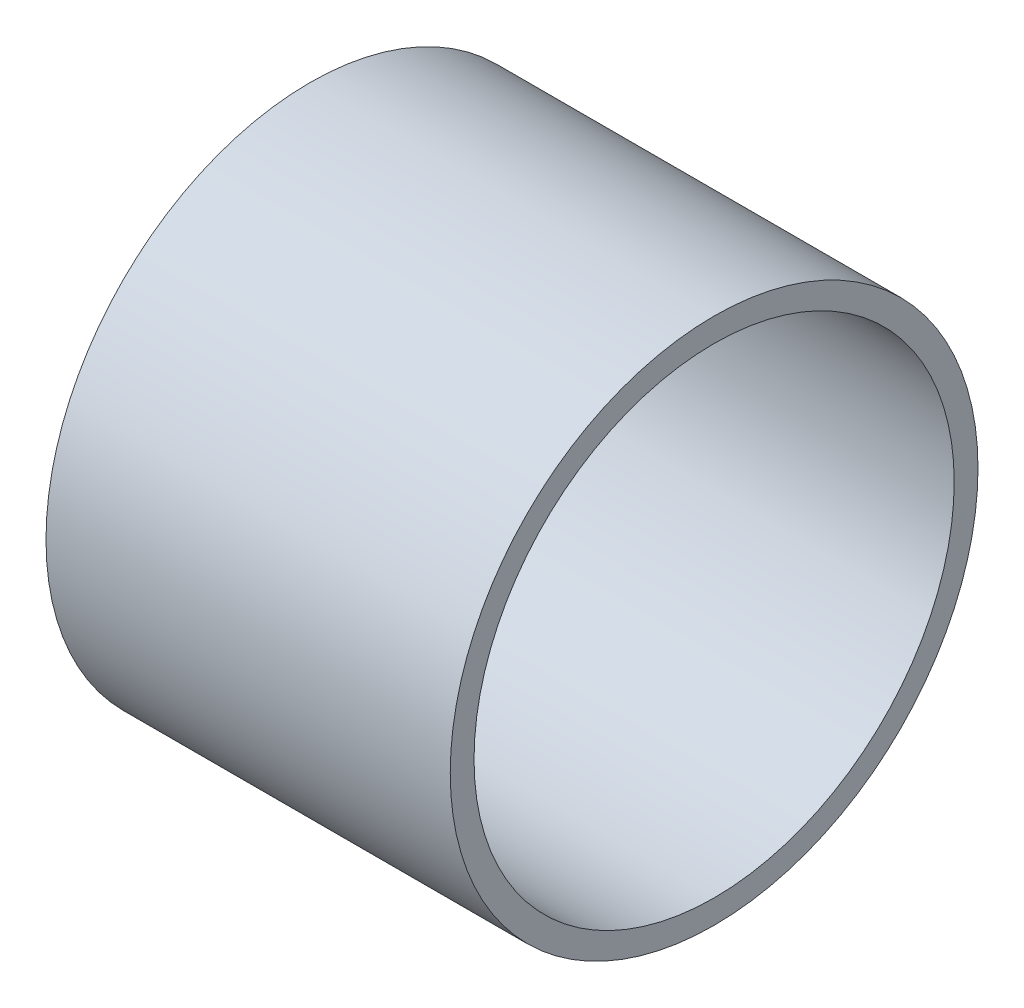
SolidWorks part; units mm, degrees
ref_plane "Plan de face" through (0, 0, 0) normal (0, 0, 1) x (1, 0, 0)
ref_plane "Plan de dessus" through (0, 0, 0) normal (0, 1, 0) x (1, 0, 0)
ref_plane "Plan de droite" through (0, 0, 0) normal (1, 0, 0) x (0, 0, -1)
sketch "Esquisse1" plane through (800, 0, 0) normal (1, 0, 0) x (0, 0, -1)
  circle A0 centre (0, -7.9069) radius 69.85
  dimension "D1" = 139.7
extrude "Extru.-Mince1" add sketch "Esquisse1" against normal blind 107 thin
